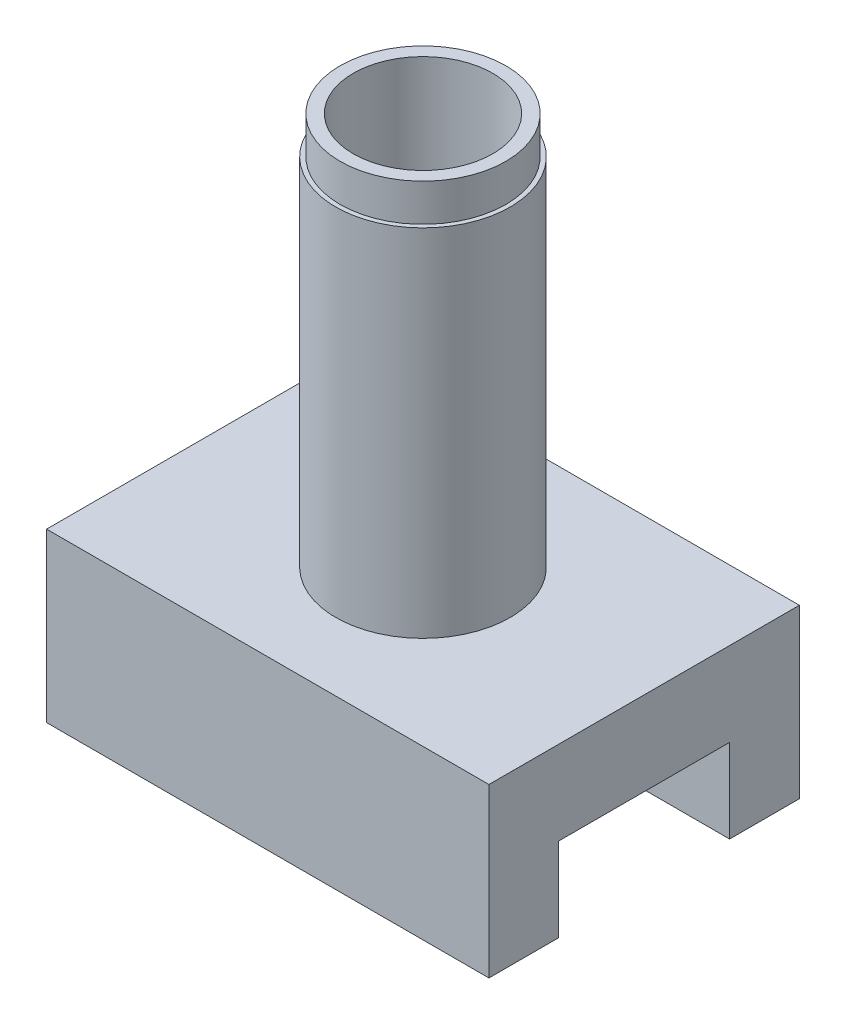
SolidWorks part; units mm, degrees
ref_plane "Front Plane" through (0, 0, 0) normal (0, 0, 1) x (1, 0, 0)
ref_plane "Top Plane" through (0, 0, 0) normal (0, 1, 0) x (1, 0, 0)
ref_plane "Right Plane" through (0, 0, 0) normal (1, 0, 0) x (0, 0, -1)
sketch "Sketch1" plane through (0, 0, 0) normal (1, 0, 0) x (0, 0, -1)
  line L0 (-56.5, -30.48) -> (-31.1, -30.48)
  line L1 (-31.1, -30.48) -> (-31.1, 0)
  line L2 (-31.1, 0) -> (31.1, 0)
  line L3 (31.1, 0) -> (31.1, -30.48)
  line L4 (31.1, -30.48) -> (56.5, -30.48)
  line L5 (56.5, -30.48) -> (56.5, 30.52)
  line L6 (56.5, 30.52) -> (-56.5, 30.52)
  line L7 (-56.5, 30.52) -> (-56.5, -30.48)
  point P0 (0, 0)
  dimension "D1" = 30.48
  dimension "D2" = 113
  dimension "D3" = 25.4
  dimension "D4" = 61
extrude "Boss-Extrude1" add sketch "Sketch1" along normal mid plane 161
sketch "Sketch2" plane through (0, 30.52, 0) normal (0, 1, 0) x (1, 0, 0)
  circle A0 centre (0, 0) radius 31.75
  circle A1 centre (0, 0) radius 25.4
  dimension "D1" = 63.5
  dimension "D2" = 50.8
extrude "Boss-Extrude2" add sketch "Sketch2" along normal blind 143
sketch "Sketch3" plane through (0, 0, 0) normal (0, 0, 1) x (1, 0, 0)
  line L0 (0, 0) -> (0, 222.5741) construction
  line L1 (31.75, 173.52) -> (30.1625, 173.52)
  line L2 (31.75, 173.52) -> (31.75, 159.92)
  line L3 (31.75, 159.92) -> (30.1625, 159.92)
  line L4 (30.1625, 173.52) -> (30.1625, 159.92)
  dimension "D1" = 60.325
  dimension "D2" = 13.6
revolve "Cut-Revolve1" cut sketch "Sketch3" angle 360 about L0
sketch "Sketch4" plane through (0, 0, 0) normal (0, 1, 0) x (1, 0, 0)
  circle A0 centre (0, 0) radius 11.1125
  dimension "D1" = 22.225
extrude "Cut-Extrude1" cut sketch "Sketch4" along normal up to next
sketch "Sketch5" plane through (0, 30.52, 0) normal (0, 1, 0) x (1, 0, 0)
  circle A0 centre (0, 0) radius 19.05
  dimension "D1" = 38.1
extrude "Cut-Extrude2" cut sketch "Sketch5" against normal blind 13.716
